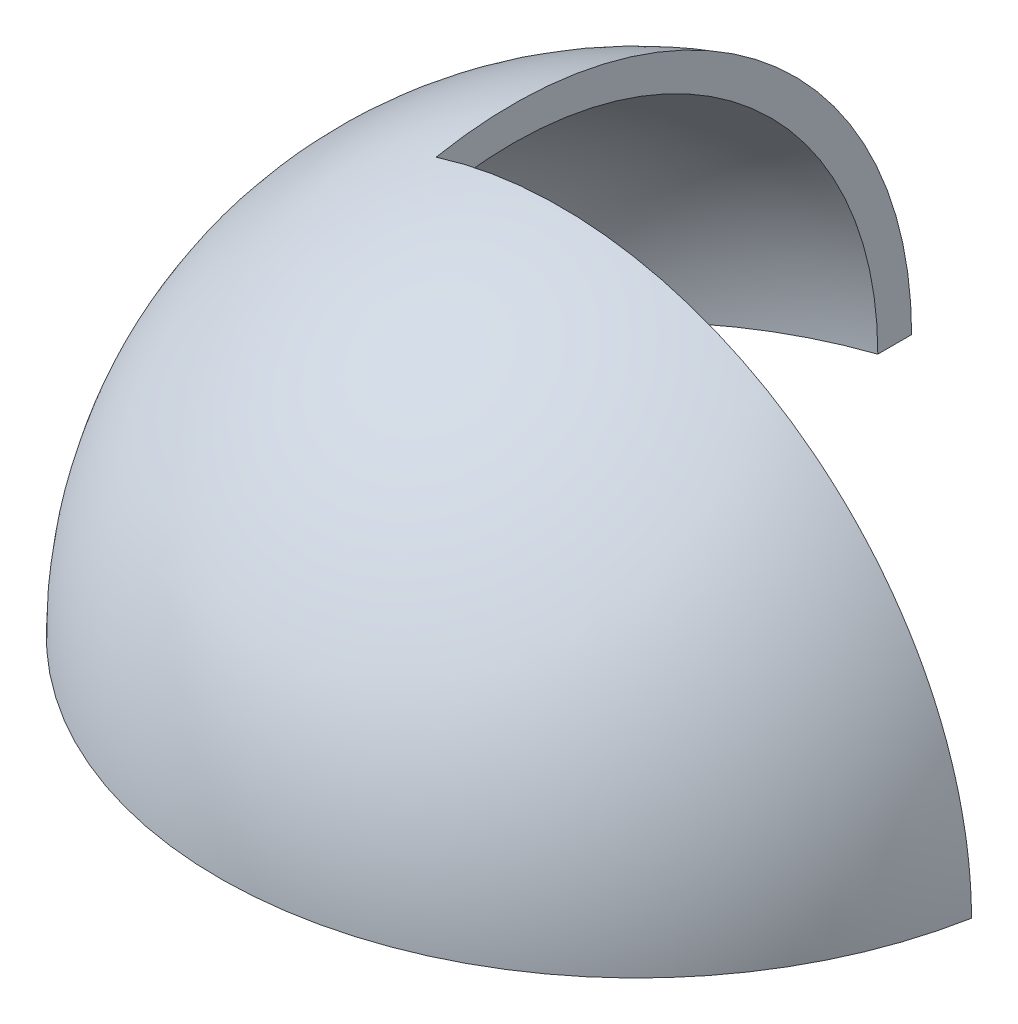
SolidWorks part; units mm, degrees
ref_plane "Front Plane" through (0, 0, 0) normal (0, 0, 1) x (1, 0, 0)
ref_plane "Top Plane" through (0, 0, 0) normal (0, 1, 0) x (1, 0, 0)
ref_plane "Right Plane" through (0, 0, 0) normal (1, 0, 0) x (0, 0, -1)
sketch "Sketch1" plane through (0, 0, 0) normal (0, 1, 0) x (1, 0, 0)
  line L0 (-94.2828, 0) -> (128.1616, 0) construction
  line L1 (-60, 0) -> (-65, 0)
  line L2 (60, 0) -> (65, 0)
  arc A0 (65, 0) -> (-65, 0) centre (0, 0) ccw
  arc A1 (60, 0) -> (-60, 0) centre (0, 0) ccw
  dimension "D1" = 130
  dimension "D2" = 120
revolve "Revolve3" add sketch "Sketch1" angle 180 about L2
sketch "Sketch2" plane through (0, 0, 0) normal (0, 1, 0) x (1, 0, 0)
  line L1 (-19.3715, 84.913) -> (68.0381, 84.913)
  line L2 (-19.3715, 84.913) -> (-19.3715, -11.9191)
  line L3 (-19.3715, -11.9191) -> (68.0381, -11.9191)
  line L4 (68.0381, 84.913) -> (68.0381, -11.9191)
extrude "Cut-Extrude1" cut sketch "Sketch2" along normal through all and the other way through all
